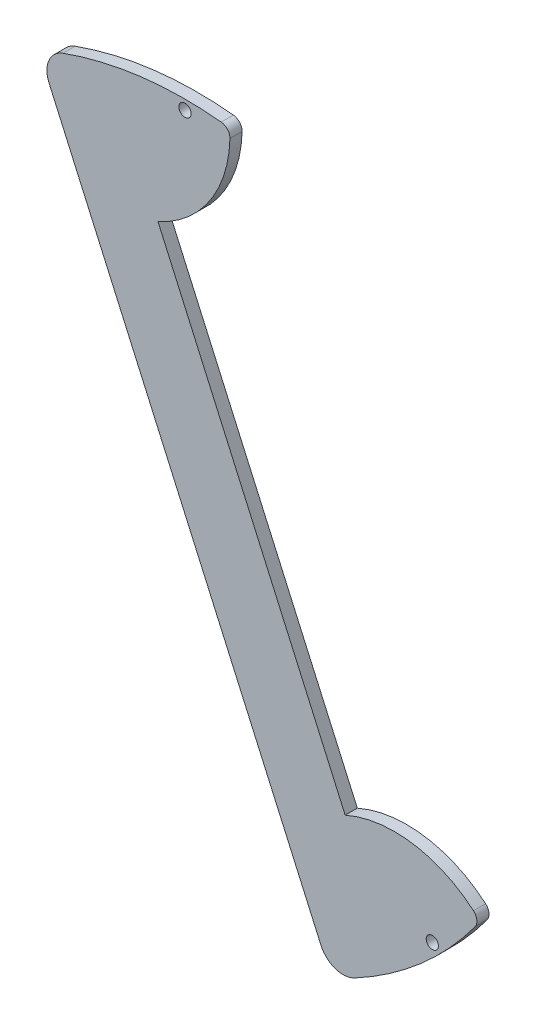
SolidWorks part; units mm, degrees
ref_plane "Front Plane" through (0, 0, 0) normal (0, 0, 1) x (1, 0, 0)
ref_plane "Top Plane" through (0, 0, 0) normal (0, 1, 0) x (1, 0, 0)
ref_plane "Right Plane" through (0, 0, 0) normal (1, 0, 0) x (0, 0, -1)
sketch "Sketch1" plane through (0, 0, 0) normal (0, 0, 1) x (1, 0, 0)
  line L0 (0, 91.44) -> (0, 0) construction
  line L1 (0, 0) -> (64.6578, -64.6578) construction
  line L2 (-35.5486, 79.8435) -> (35.5486, -79.8435)
  line L3 (41.8776, -47.2224) -> (79.4369, -30.4999) construction
  line L4 (0, 0) -> (63.9222, 28.46) construction
  line L5 (-7.0715, 62.7191) -> (30.4878, 79.4416) construction
  line L6 (-7.0715, 62.7191) -> (41.8776, -47.2224)
  line L7 (0, 0) -> (-22.7358, 91.1884) construction
  line L8 (0, 0) -> (52.5529, -77.913) construction
  circle A0 centre (0, 0) radius 91.44 construction
  arc A1 (44.346, -82.8594) -> (75.8225, -55.5265) centre (0, 0) ccw
  circle A2 centre (0, 91.44) radius 1.5964
  circle A3 centre (64.6578, -64.6578) radius 1.5964
  arc A4 (75.4238, -52.0952) -> (41.8776, -47.2224) centre (54.7915, -76.2275) ccw
  arc A5 (9.471, 93.5016) -> (-31.9032, 88.3992) centre (0, 0) ccw
  arc A6 (11.7541, 90.9093) -> (-7.0715, 62.7191) centre (-19.9854, 91.7241) cw
  arc A7 (11.7541, 90.9093) -> (9.471, 93.5016) centre (9.215, 90.9745) ccw
  arc A8 (75.8225, -55.5265) -> (75.4238, -52.0952) centre (73.7732, -54.0258) ccw
  arc A9 (-31.9032, 88.3992) -> (-35.5486, 79.8435) centre (-29.7476, 82.4263) ccw
  arc A10 (44.346, -82.8594) -> (35.5486, -79.8435) centre (41.3496, -77.2608) cw
  point P20 (17.403, 7.7483)
  point P21 (11.7281, 93.2453)
  point P24 (77.1424, -53.6776)
  dimension "D1" = 182.88
  dimension "D2" = 187.96
  dimension "D8" = 2.54
  dimension "D6" = 3.1928
  dimension "D5" = 31.75
  dimension "D9" = 2.54
  dimension "D10" = 6.35
  dimension "D3" = 135
  dimension "D4" = 24
  dimension "D7" = 19.05
  dimension "D11" = 10
  dimension "D12" = 10
extrude "Extrude1" add sketch "Sketch1" along normal blind 3.175
hole_wizard "#4-40 Tapped Hole2" positions "Sketch4" profile "Sketch3" tap size "#4-40" standard "Ansi Inch"
sketch "Sketch4" plane through (0, 0, 0) normal (-0.9135, -0.4067, 0) x (0, 0, 1)
  line L0 (0, 87.3996) -> (0, -87.3996) construction
  point P0 (1.5875, 76.2)
  point P1 (1.5875, 0)
  point P3 (1.5875, -76.2)
  dimension "D1" = 76.2
  dimension "D2" = 76.2
  dimension "D3" = 1.5875
sketch "Sketch3" plane through (-30.9933, 69.6122, 1.5875) normal (0, 0, 1) x (0.4067, -0.9135, 0)
  line L0 (0, 0) -> (0, 9.5692)
  line L1 (0, 9.5692) -> (1.1303, 8.89)
  line L2 (1.1303, 8.89) -> (1.1303, 0)
  line L5 (1.1303, 0) -> (0, 0)
  line L10 (0, 9.5692) -> (-1.1303, 8.89) construction
  line L11 (0, -6.35) -> (0, 107.95) construction
  dimension "Tap Drill Dia." = 2.2606
  dimension "Tap Drill Depth" = 8.89
  dimension "Drill Angle" = 118
